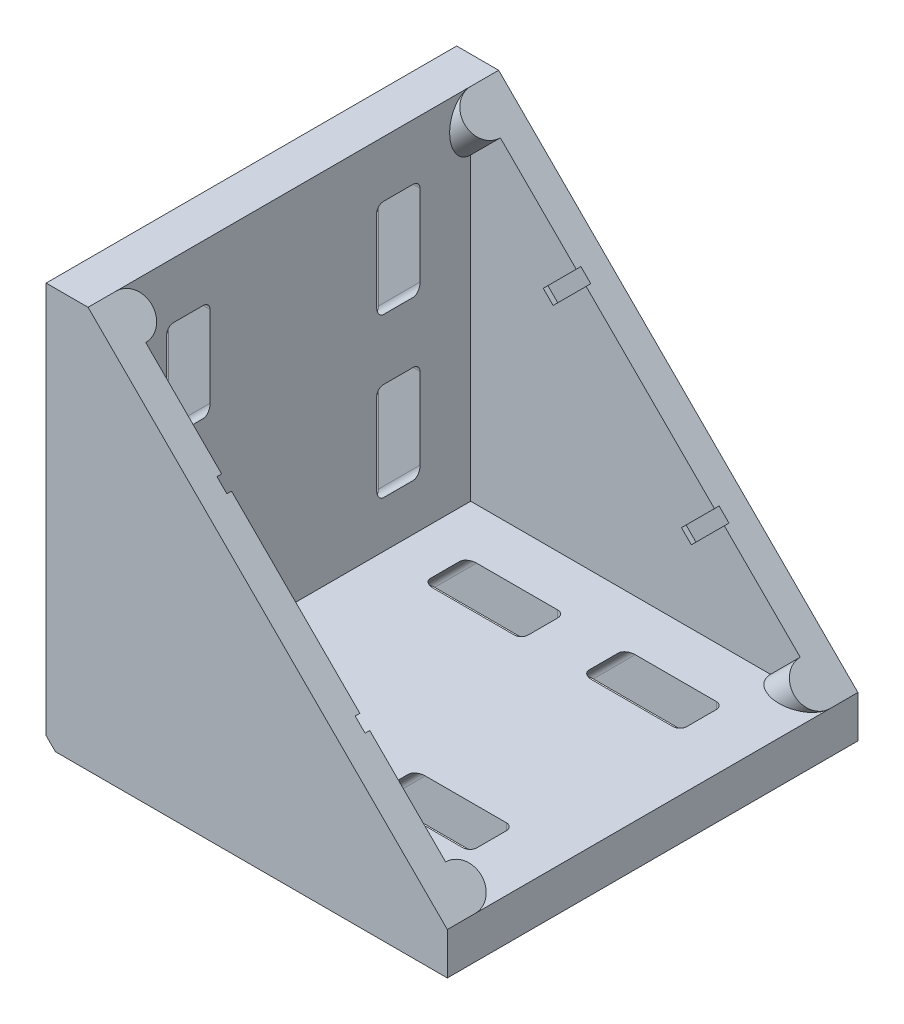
SolidWorks part; units mm, degrees
ref_plane "前视基准面" through (0, 0, 0) normal (0, 0, 1) x (1, 0, 0)
ref_plane "上视基准面" through (0, 0, 0) normal (0, 1, 0) x (1, 0, 0)
ref_plane "右视基准面" through (0, 0, 0) normal (1, 0, 0) x (0, 0, -1)
sketch "草图1" plane through (0, 0, 0) normal (0, 0, 1) x (1, 0, 0)
  line L0 (0, 0) -> (0, 86)
  line L1 (0, 0) -> (86, 0)
  line L2 (0, 86) -> (9, 86)
  line L3 (86, 0) -> (86, 9)
  line L4 (86, 9) -> (9, 86)
  dimension "D1" = 86
  dimension "D2" = 86
  dimension "D3" = 9
  dimension "D4" = 9
extrude "凸台-拉伸1" add sketch "草图1" along normal mid plane 88
sketch "草图2" plane through (0, 86, 0) normal (0, 1, 0) x (1, 0, 0)
  line L0 (9, 38) -> (86, 38)
  line L1 (9, -44) -> (9, 44) construction
  line L2 (86, -44) -> (86, 44) construction
  line L3 (9, -38) -> (86, -38)
  line L4 (9, 38) -> (9, -38)
  line L5 (86, 38) -> (86, -38)
  dimension "D1" = 6
  dimension "D2" = 6
extrude "切除-拉伸1" cut sketch "草图2" against normal blind 77
sketch "草图3" plane through (47.5, 47.5, 0) normal (0.7071, 0.7071, 0) x (0, 0, -1)
  line L0 (-38, 22.4472) -> (-39, 22.4472)
  line L1 (-38, -54.4472) -> (-38, 54.4472) construction
  line L2 (-39, 22.4472) -> (-39, 19.4472)
  line L3 (-39, 19.4472) -> (-38, 19.4472)
  line L4 (-38, -22.4472) -> (-39, -22.4472)
  line L5 (-39, -22.4472) -> (-39, -19.4472)
  line L6 (-39, -19.4472) -> (-38, -19.4472)
  line L7 (-38, -19.4472) -> (-38, -22.4472)
  line L8 (-38, 22.4472) -> (-38, 19.4472)
  line L9 (0, 0) -> (0, -88.0388) construction
  line L10 (38, 22.4472) -> (38, 19.4472)
  line L11 (38, -19.4472) -> (38, -22.4472)
  line L12 (39, -19.4472) -> (38, -19.4472)
  line L13 (39, -22.4472) -> (39, -19.4472)
  line L14 (38, -22.4472) -> (39, -22.4472)
  line L15 (39, 19.4472) -> (38, 19.4472)
  line L16 (39, 22.4472) -> (39, 19.4472)
  line L17 (38, 22.4472) -> (39, 22.4472)
  dimension "D1" = 32
  dimension "D2" = 1
  dimension "D3" = 3
  dimension "D4" = 32
  dimension "D5" = 3
  dimension "D6" = 1
extrude "切除-拉伸2" cut sketch "草图3" against normal blind 10
sketch "草图4" plane through (47.5, 47.5, 0) normal (0.7071, 0.7071, 0) x (0, 0, -1)
  line L0 (-38, 22.4472) -> (-38, 54.4472) construction
  line L1 (-38, 54.4472) -> (-38, 45.4472)
  line L2 (0, 0) -> (-95.3098, 0) construction
  line L3 (0, 0) -> (0, 94.4888) construction
  line L4 (38, 54.4472) -> (38, 45.4472)
  line L5 (-38, -54.4472) -> (-38, -45.4472)
  line L6 (38, -54.4472) -> (38, -45.4472)
  arc A0 (-38, 45.4472) -> (-38, 54.4472) centre (-38, 49.9472) ccw
  arc A1 (38, 45.4472) -> (38, 54.4472) centre (38, 49.9472) cw
  arc A2 (-38, -45.4472) -> (-38, -54.4472) centre (-38, -49.9472) cw
  arc A3 (38, -45.4472) -> (38, -54.4472) centre (38, -49.9472) ccw
  dimension "D1" = 4.5
  dimension "D2" = 9
extrude "凸台-拉伸2" add sketch "草图4" against normal up to body
sketch "草图6" plane through (0, 9, 0) normal (0, 1, 0) x (1, 0, 0)
  line L0 (0, 0) -> (111.0454, 0) construction
  line L1 (55.5, 27.15) -> (72.5, 27.15)
  line L2 (54, 25.65) -> (54, 19.35)
  line L3 (55.5, 17.85) -> (72.5, 17.85)
  line L4 (74, 25.65) -> (74, 19.35)
  line L5 (21.5, 27.15) -> (38.5, 27.15)
  line L6 (20, 25.65) -> (20, 19.35)
  line L7 (21.5, 17.85) -> (38.5, 17.85)
  line L8 (40, 25.65) -> (40, 19.35)
  line L9 (54, -17.85) -> (55.5, -17.85)
  line L10 (54, -19.35) -> (54, -17.85)
  line L11 (74, -17.85) -> (72.5, -17.85)
  line L12 (74, -19.35) -> (74, -17.85)
  line L13 (74, -27.15) -> (74, -25.65)
  line L14 (72.5, -27.15) -> (74, -27.15)
  line L15 (54, -27.15) -> (54, -25.65)
  line L16 (55.5, -27.15) -> (54, -27.15)
  line L17 (21.5, 27.15) -> (20, 27.15)
  line L18 (20, 27.15) -> (20, 25.65)
  line L19 (38.5, 27.15) -> (40, 27.15)
  line L20 (40, 27.15) -> (40, 25.65)
  line L21 (20, 19.35) -> (20, 17.85)
  line L22 (20, 17.85) -> (21.5, 17.85)
  line L23 (40, 19.35) -> (40, 17.85)
  line L24 (40, 17.85) -> (38.5, 17.85)
  line L25 (40, -17.85) -> (38.5, -17.85)
  line L26 (55.5, 27.15) -> (54, 27.15)
  line L27 (54, 27.15) -> (54, 25.65)
  line L28 (72.5, 27.15) -> (74, 27.15)
  line L29 (74, 27.15) -> (74, 25.65)
  line L30 (74, 19.35) -> (74, 17.85)
  line L31 (74, 17.85) -> (72.5, 17.85)
  line L32 (54, 19.35) -> (54, 17.85)
  line L33 (54, 17.85) -> (55.5, 17.85)
  line L34 (40, -19.35) -> (40, -17.85)
  line L35 (20, -17.85) -> (21.5, -17.85)
  line L36 (20, -19.35) -> (20, -17.85)
  line L37 (40, -27.15) -> (40, -25.65)
  line L38 (38.5, -27.15) -> (40, -27.15)
  line L39 (20, -27.15) -> (20, -25.65)
  line L40 (21.5, -27.15) -> (20, -27.15)
  line L41 (40, -25.65) -> (40, -19.35)
  line L42 (21.5, -17.85) -> (38.5, -17.85)
  line L43 (20, -25.65) -> (20, -19.35)
  line L44 (21.5, -27.15) -> (38.5, -27.15)
  line L45 (74, -25.65) -> (74, -19.35)
  line L46 (55.5, -17.85) -> (72.5, -17.85)
  line L47 (54, -25.65) -> (54, -19.35)
  line L48 (55.5, -27.15) -> (72.5, -27.15)
  point P14 (74, 27.15)
  point P17 (74, 17.85)
  point P20 (54, 17.85)
  point P25 (40, 17.85)
  point P28 (40, 27.15)
  point P31 (20, 27.15)
  dimension "D1" = 16.85
  dimension "D2" = 16.85
  dimension "D3" = 12
  dimension "D4" = 9.3
  dimension "D5" = 9.3
  dimension "D6" = 20
  dimension "D7" = 14
extrude "切除-拉伸3" cut sketch "草图6" against normal blind 10
sketch "草图7" plane through (0, 0, 0) normal (0, -1, 0) x (1, 0, 0)
  line L0 (0, 0) -> (114.4566, 0) construction
  line L1 (11, -15.05) -> (11, -3.05)
  line L2 (71, 40.2) -> (11, 40.2)
  line L3 (71, 40.2) -> (71, 31.7)
  line L4 (71, 31.7) -> (11, 31.7)
  line L5 (11, 40.2) -> (11, 31.7)
  line L6 (71, 15.05) -> (11, 15.05)
  line L7 (71, 15.05) -> (71, 3.05)
  line L8 (71, 3.05) -> (11, 3.05)
  line L9 (11, 15.05) -> (11, 3.05)
  line L10 (71, -3.05) -> (11, -3.05)
  line L11 (71, -15.05) -> (71, -3.05)
  line L12 (71, -15.05) -> (11, -15.05)
  line L13 (11, -40.2) -> (11, -31.7)
  line L14 (71, -31.7) -> (11, -31.7)
  line L15 (71, -40.2) -> (71, -31.7)
  line L16 (71, -40.2) -> (11, -40.2)
  dimension "D1" = 3.8
  dimension "D2" = 15
  dimension "D3" = 11
  dimension "D4" = 8.5
  dimension "D5" = 2.8
  dimension "D6" = 12
extrude "切除-拉伸5" cut sketch "草图7" against normal blind 5
ref_plane "基准面1" through (0, 0, 0) normal (-0.7071, 0.7071, 0) x (0.7071, 0.7071, 0)
mirror "镜向1" about plane through (0, 0, 0) normal (-0.7071, 0.7071, 0) of "切除-拉伸5", "切除-拉伸3"
chamfer "倒角1" distance 5 angle 45 16 edges at (0, 71, -35.95) (0, 71, -9.05) (0, 71, 9.05) (0, 71, 35.95) (0, 11, -35.95) (0, 11, -9.05) (0, 11, 9.05) (0, 11, 35.95) (11, 0, -35.95) (11, 0, -9.05) (11, 0, 9.05) (11, 0, 35.95) (71, 0, 9.05) (71, 0, -9.05) (71, 0, -35.95) (71, 0, 35.95)
chamfer "倒角3" distance 10 angle 45 8 edges at (20, 0, 22.5) (54, 0, 22.5) (54, 0, -22.5) (20, 0, -22.5) (0, 20, 22.5) (0, 54, 22.5) (0, 20, -22.5) (0, 54, -22.5)
fillet "圆角1" radius 1.5 16 edges at (4.5, 74, 27.15) (4.5, 74, 17.85) (4.5, 48.5, 27.15) (4.5, 48.5, 17.85) (4.5, 40, 27.15) (4.5, 40, 17.85) (4.5, 14.5, 27.15) (4.5, 14.5, 17.85) (4.5, 40, -27.15) (4.5, 40, -17.85) (4.5, 14.5, -17.85) (4.5, 14.5, -27.15) (4.5, 48.5, -17.85) (4.5, 48.5, -27.15) (4.5, 74, -17.85) (4.5, 74, -27.15)
fillet "圆角2" radius 1.5 16 edges at (48.5, 4.5, -27.15) (74, 4.5, -27.15) (74, 4.5, -17.85) (48.5, 4.5, -17.85) (40, 4.5, -27.15) (40, 4.5, -17.85) (14.5, 4.5, -27.15) (14.5, 4.5, -17.85) (74, 4.5, 17.85) (74, 4.5, 27.15) (48.5, 4.5, 27.15) (48.5, 4.5, 17.85) (40, 4.5, 27.15) (40, 4.5, 17.85) (14.5, 4.5, 17.85) (14.5, 4.5, 27.15)
chamfer "倒角4" distance 2 angle 45 1 edges at (0, 0, 0)
sketch "草图8" plane through (0, 0, 0) normal (-1, 0, 0) x (0, 0, 1)
  line L1 (-27.5, 77.782) -> (-17.5, 77.782)
  line L2 (-27.5, 77.782) -> (-27.5, 79.782)
  line L3 (-27.5, 79.782) -> (-17.5, 79.782)
  line L4 (-17.5, 77.782) -> (-17.5, 79.782)
  line L5 (-27.5, 7.6087) -> (-17.5, 7.6087)
  line L6 (-27.5, 7.6087) -> (-27.5, 5.6087)
  line L7 (-27.5, 5.6087) -> (-17.5, 5.6087)
  line L8 (-17.5, 7.6087) -> (-17.5, 5.6087)
  line L9 (-22.5, 74) -> (-22.5, 88.6414) construction
  line L10 (-19.35, 74) -> (-25.65, 74) construction
  line L11 (-22.5, 19) -> (-22.5, -3.0657) construction
  line L12 (-25.65, 19) -> (-19.35, 19) construction
  point P3 (-22.5, 79.782)
  point P7 (-22.5, 7.6087)
  point P14 (-22.5, 77.782)
  point P20 (-22.5, 5.6087)
  dimension "D1" = 5
  dimension "D2" = 2
  dimension "D3" = 5
  dimension "D4" = 2
extrude "凸台-拉伸3" add sketch "草图8" along normal blind 4
mirror "镜向4" about plane through (0, 0, 0) normal (0, 0, 1) of "凸台-拉伸3"
mirror "镜向5" about plane through (0, 0, 0) normal (-0.7071, 0.7071, 0) of "镜向4", "凸台-拉伸3"
chamfer "倒角5" distance 1 angle 45 16 edges at (78.782, -4, 27.5) (78.782, -4, 17.5) (78.782, -4, -17.5) (78.782, -4, -27.5) (6.6087, -4, 27.5) (6.6087, -4, 17.5) (6.6087, -4, -17.5) (6.6087, -4, -27.5) (-4, 6.6087, 27.5) (-4, 6.6087, 17.5) (-4, 6.6087, -17.5) (-4, 6.6087, -27.5) (-4, 78.782, 27.5) (-4, 78.782, 17.5) (-4, 78.782, -17.5) (-4, 78.782, -27.5)
